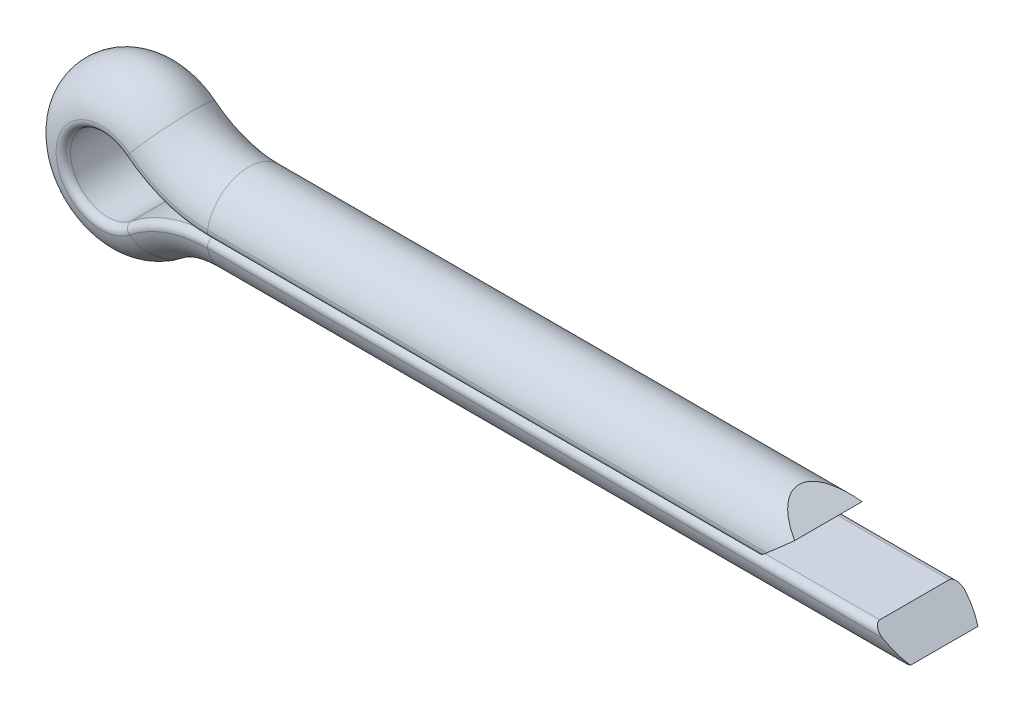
SolidWorks part; units mm, degrees
ref_plane "Front Plane" through (0, 0, 0) normal (0, 0, 1) x (1, 0, 0)
ref_plane "Top Plane" through (0, 0, 0) normal (0, 1, 0) x (1, 0, 0)
ref_plane "Right Plane" through (0, 0, 0) normal (1, 0, 0) x (0, 0, -1)
other "Configuration Table"
sketch "PathSke" plane through (0, 0, 0) normal (0, 0, 1) x (1, 0, 0)
  line L0 (0, 0) -> (38.8652, 0) construction
  line L1 (0, 0) -> (0, 12.2501) construction
  line L2 (3.665, 0) -> (3.665, 12.2501) construction
  line L3 (3.665, 1.45) -> (23.665, 1.45)
  line L4 (3.665, -1.45) -> (27.665, -1.45)
  line L5 (0, 0) -> (-2.735, 0) construction
  arc A0 (1.7079, 2.1362) -> (1.7079, -2.1362) centre (0, 0) ccw
  arc A1 (3.665, 1.45) -> (1.7079, 2.1362) centre (3.665, 4.584) cw
  arc A2 (3.665, -1.45) -> (1.7079, -2.1362) centre (3.665, -4.584) ccw
ref_plane "SectionPlane" through (23.665, 1.45, 0) normal (1, 0, 0) x (0, 0, -1)
sketch "SectionSke" plane through (23.665, 1.45, 0) normal (1, 0, 0) x (0, 0, -1)
  line L0 (0, -1.45) -> (0, 8.6928) construction
  line L1 (0, -1.45) -> (0, 10.8001) construction
  line L2 (-1.45, -1.45) -> (1.45, -1.45) construction
  line L3 (-1.1977, -1.448) -> (1.1977, -1.448)
  arc A0 (1.4235, -1.1743) -> (-1.4235, -1.1743) centre (0, -1.45) ccw
  arc A1 (-1.1977, -1.448) -> (-1.4235, -1.1743) centre (-1.1977, -1.218) cw
  arc A2 (1.4235, -1.1743) -> (1.1977, -1.448) centre (1.1977, -1.218) cw
sweep "BaseBody" add profiles "SectionSke" path "PathSke"
sketch "ConeCutSke" plane through (0, 0, 0) normal (0, 0, 1) x (1, 0, 0)
  line L0 (0, 0) -> (34.6884, 0) construction
  line L1 (22.6339, 1.46) -> (27.675, 1.46)
  line L2 (27.675, 1.46) -> (27.675, -1.46)
  line L3 (23.665, 1.45) -> (3.665, 1.45) construction
  line L4 (22.6339, 1.46) -> (23.665, 0.8629)
  line L5 (23.665, 0.2757) -> (23.665, 1.45) construction
  line L6 (23.665, 0.8629) -> (22.6339, 0)
  line L7 (22.6339, 0) -> (26.6339, 0)
  line L8 (26.6339, 0) -> (27.665, -0.8629)
  line L9 (27.665, -1.45) -> (27.665, -0.2757) construction
  line L10 (27.665, -0.8629) -> (26.6339, -1.46)
  line L11 (26.6339, -1.46) -> (27.675, -1.46)
  point P19 (27.675, 0)
  dimension "D1" = 0.01
  dimension "D2" = 70
  dimension "D3" = 70
  dimension "D4" = 0.01
extrude "ConeCut" cut sketch "ConeCutSke" against normal through all and the other way through all
equation "\"Diameter@SectionSke\" = \"Diameter@PathSke\""
